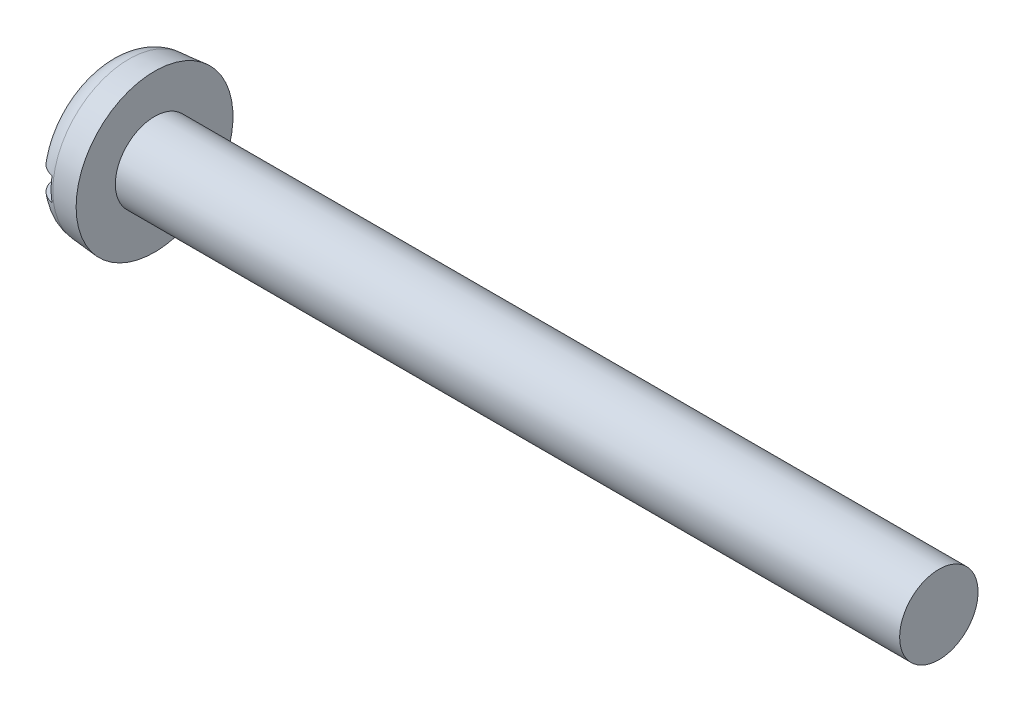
SolidWorks part; units mm, degrees
ref_plane "Plane1" through (0, 0, 0) normal (0, 0, 1) x (1, 0, 0)
ref_plane "Plane2" through (0, 0, 0) normal (0, 1, 0) x (1, 0, 0)
ref_plane "Plane3" through (0, 0, 0) normal (1, 0, 0) x (0, 0, -1)
sketch "BodySke" plane through (0, 0, 0) normal (0, 0, 1) x (1, 0, 0)
  line L0 (2.4, 2) -> (2.4, 4)
  line L1 (0, 0) -> (0, 3.79)
  line L2 (-25.4, 0) -> (127, 0) construction
  line L3 (42.4, 0) -> (0, 0)
  line L4 (2.4, 2) -> (42.4, 2)
  line L5 (42.4, 2) -> (42.4, 0)
  line L6 (0, 3.79) -> (2.4, 4)
  line L9 (3.1, 3.5875) -> (3.1, -5.9375) construction
  line L10 (2.4, 6.35) -> (2.4, -3.175) construction
  dimension "Head_ht" = 2.4
  dimension "Diameter" = 4
  dimension "Length" = 40
  dimension "Head_dia" = 8
  dimension "Advance" = 0.7
  dimension "Thread_nom" = 40
  dimension "Head_side_angle" = 5
revolve "Base-Revolve" add sketch "BodySke"
fillet "Fillet1" [suppressed] radius 0.2
fillet "Fillet2" radius 1.2 1 edges at (0, 0, 3.79)
sketch "Sketch2" plane through (0, 0, 0) normal (1, 0, 0) x (0, 0, -1)
  line L0 (4, -0.6) -> (-4, -0.6)
  line L1 (4, -0.6) -> (4, 0.6)
  line L2 (-4, 0.6) -> (4, 0.6)
  line L3 (-4, 0.6) -> (-4, -0.6)
  dimension "D1" = 8
  dimension "D2" = 4
  dimension "Slot_width" = 1.2
  dimension "D3" = 0.6
extrude "Slot" cut sketch "Sketch2" along normal blind 1
sketch "ThdSchSke" plane through (0, 0, 0) normal (0, 0, 1) x (1, 0, 0)
  line L0 (3.8, -1.61) -> (3.5269, -2)
  line L1 (3.8, -1.61) -> (4.0731, -2)
  line L2 (4.0731, -2) -> (4.0731, -2.5)
  line L3 (-3.175, 0) -> (5.1513, 0) construction
  line L5 (4.0731, -2.5) -> (3.5269, -2.5)
  line L6 (3.5269, -2.5) -> (3.5269, -2)
  dimension "Thread_minor" = 3.22
  dimension "Diameter" = 4
  dimension "Start" = 3.8
  dimension "SideAngle" = 55
  dimension "VeeAngle" = 70
  dimension "Overcut" = 5
revolve "ThreadSchematic" [suppressed] cut sketch "ThdSchSke" angle 360 about L3
pattern_linear "ThdSchPat" [suppressed]
equation "\"D1@Sketch2\" = \"Head_dia@BodySke\""
equation "\"D2@Sketch2\" = \"D1@Sketch2\" / 2"
equation "\"D3@Sketch2\" = \"Slot_width@Sketch2\" / 2"
equation "\"Thread_length@ThreadCosmetic\" = ((sgn( (\"Length@BodySke\" - \"Advance@BodySke\" * 2.0 ) - \"Thread_nom@BodySke\" )-1)*( (\"Length@BodySke\" - \"Advance@BodySke\"  * 2.0) - \"Thread_nom@BodySke\" ))/-2+ \"Thread_"
equation "\"Thread_minor@ThdSchSke\" = \"Thread_minor@ThreadCosmetic\""
equation "\"Diameter@ThdSchSke\" = \"Diameter@BodySke\""
equation "\"Overcut@ThdSchSke\" = \"Diameter@BodySke\" * 1.25"
equation "\"Start@ThdSchSke\" = \"Head_ht@BodySke\" + \"Length@BodySke\" - \"Thread_length@ThreadCosmetic\"  '---Non-countersunk---"
equation "\"Num_threads@ThdSchPat\" = int( \"Thread_length@ThreadCosmetic\" / \"Advance@BodySke\" + 0.999 )  + 1"
equation "\"Advance@ThdSchPat\" = \"Thread_length@ThreadCosmetic\" /  (\"Num_threads@ThdSchPat\" - 1) 'relax it"
